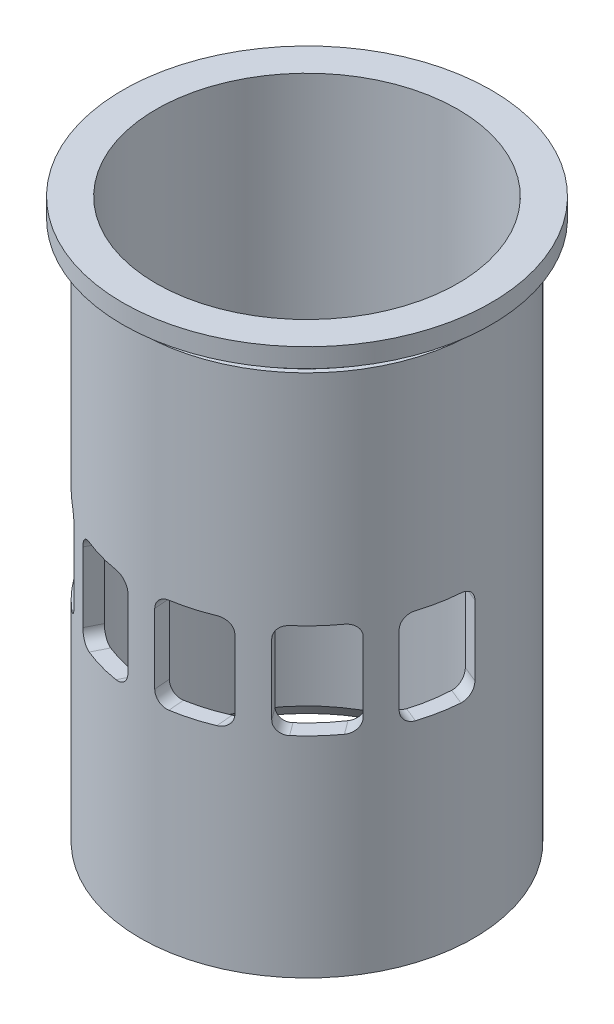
SolidWorks part; units mm, degrees
ref_plane "Plan1" through (0, 0, 0) normal (0, 0, 1) x (1, 0, 0)
ref_plane "Plan2" through (0, 0, 0) normal (0, 1, 0) x (1, 0, 0)
ref_plane "Plan3" through (0, 0, 0) normal (1, 0, 0) x (0, 0, -1)
sketch "Esquisse1" plane through (0, 0, 0) normal (0, 0, 1) x (1, 0, 0)
  line L0 (0, 45.1) -> (0, -10.5) construction
  line L1 (11.875, 0) -> (11.875, 44)
  line L2 (11.875, 44) -> (14.5, 44)
  line L3 (14.5, 44) -> (14.5, 42.5)
  line L4 (14.5, 42.5) -> (12.75, 42.5)
  line L5 (12.75, 42.5) -> (12.75, 41.25)
  line L6 (12.75, 41.25) -> (13.13, 41.25)
  line L7 (13.13, 41.25) -> (13.13, 0)
  line L8 (13.13, 0) -> (11.875, 0)
  dimension "D1" = 13.13
  dimension "D2" = 12.75
  dimension "D3" = 11.875
  dimension "D4" = 14.5
  dimension "D5" = 44
  dimension "D6" = 1.5
  dimension "D7" = 1.25
revolve "Base-Révolution" add sketch "Esquisse1" angle 360 about L0
chamfer "Chanfrein1" distance 0.5 angle 60
sketch "Esquisse2" plane through (0, 0, 0) normal (1, 0, 0) x (0, 0, -1)
  line L0 (0, 0) -> (0, 0.866) construction
  line L1 (-1, 24) -> (-4, 24)
  line L2 (0, 23) -> (0, 17.5)
  line L3 (-1, 16.5) -> (-4, 16.5)
  line L4 (-5, 23) -> (-5, 17.5)
  arc A0 (-5, 23) -> (-4, 24) centre (-4, 23) cw
  arc A1 (-4, 16.5) -> (-5, 17.5) centre (-4, 17.5) cw
  arc A2 (0, 17.5) -> (-1, 16.5) centre (-1, 17.5) cw
  arc A3 (-1, 24) -> (0, 23) centre (-1, 23) cw
  point P15 (0, 24)
  dimension "D4" = 1
  dimension "D1" = 24
  dimension "D2" = 16.5
  dimension "D3" = 5
extrude "Enlèv. mat.-Extru.1" cut sketch "Esquisse2" against normal up to next
pattern_circular "Répétition circulaire1" count 6 over 158 about axis through (0, 45.1, 0) along (0, -1, 0)
sketch "Esquisse3" plane through (0, 0, 0) normal (0, 0, 1) x (1, 0, 0)
  line L1 (-1.5, 22.5) -> (1.5, 22.5)
  line L2 (-2.5, 21.5) -> (-2.5, 17.5)
  line L3 (-1.5, 16.5) -> (1.5, 16.5)
  line L4 (2.5, 21.5) -> (2.5, 17.5)
  arc A0 (-2.5, 21.5) -> (-1.5, 22.5) centre (-1.5, 21.5) cw
  arc A1 (-1.5, 16.5) -> (-2.5, 17.5) centre (-1.5, 17.5) cw
  arc A2 (2.5, 17.5) -> (1.5, 16.5) centre (1.5, 17.5) cw
  arc A3 (1.5, 22.5) -> (2.5, 21.5) centre (1.5, 21.5) cw
  dimension "D5" = 1
  dimension "D1" = 22.5
  dimension "D2" = 16.5
  dimension "D3" = 5
  dimension "D4" = 2.5
extrude "Enlèv. mat.-Extru.2" cut sketch "Esquisse3" against normal up to next
pattern_circular "Répétition circulaire2" count 2 every 30 about axis through (0, 45.1, 0) along (0, -1, 0)
pattern_circular "Répétition circulaire3" count 2 every 30 about axis through (0, 45.1, 0) along (0, -1, 0)
sketch "Esquisse4" plane through (0, 0, 0) normal (0, 1, 0) x (1, 0, 0)
  line L1 (-37.5, -19.1) -> (20.4, -19.1)
  line L2 (-37.5, -19.1) -> (-37.5, 0)
  line L3 (-37.5, 0) -> (20.4, 0)
  line L4 (20.4, -19.1) -> (20.4, 0)
extrude "Enlèv. mat.-Extru.4" [suppressed] cut sketch "Esquisse4" along normal through all
